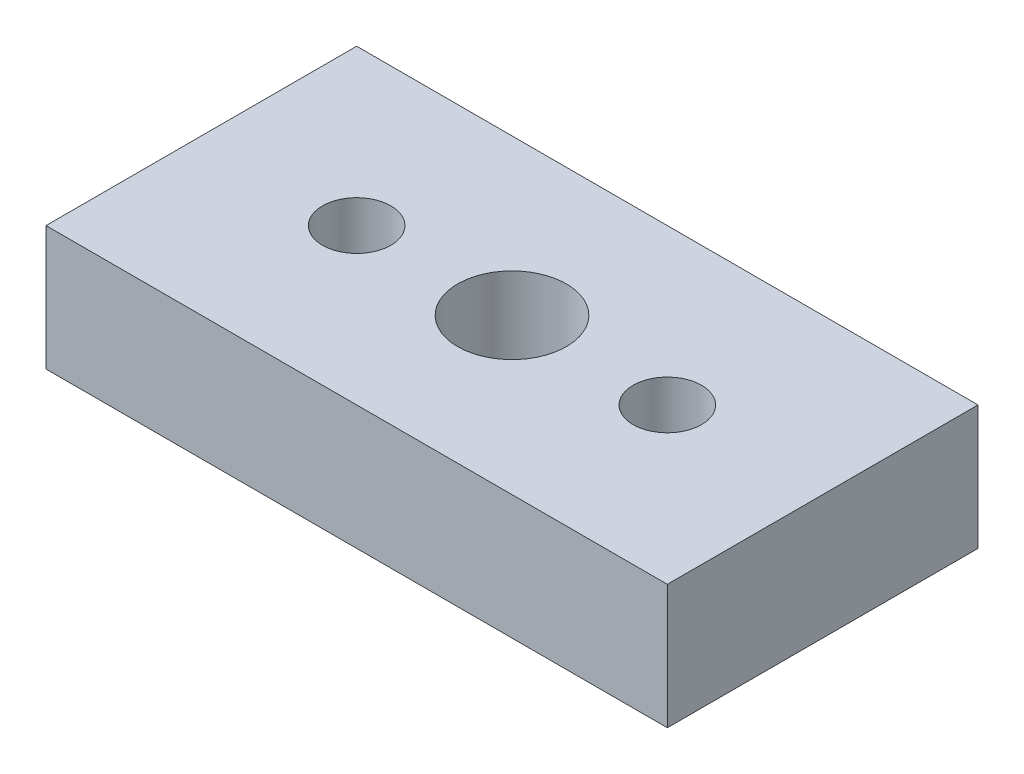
SolidWorks part; units mm, degrees
ref_plane "正面" through (0, 0, 0) normal (0, 0, 1) x (1, 0, 0)
ref_plane "平面" through (0, 0, 0) normal (0, 1, 0) x (1, 0, 0)
ref_plane "右側面" through (0, 0, 0) normal (1, 0, 0) x (0, 0, -1)
sketch "ｽｹｯﾁ1" plane through (0, 0, 0) normal (0, 1, 0) x (1, 0, 0)
  line L1 (-30, 15) -> (30, 15)
  line L2 (-30, 15) -> (-30, -15)
  line L3 (-30, -15) -> (30, -15)
  line L4 (30, 15) -> (30, -15)
  dimension "D1" = 30
  dimension "D2" = 30
  dimension "D3" = 15
  dimension "D4" = 60
extrude "押し出し1" add sketch "ｽｹｯﾁ1" along normal blind 12
hole_wizard "M12x1.5 ねじ穴1" positions "3Dｽｹｯﾁ1" profile "ｽｹｯﾁ2" tap size "M12x1.5" standard "JIS"
sketch3d "3Dｽｹｯﾁ1"
  line L0 (-30, 12, -15) -> (-30, 12, 15) construction
  line L1 (30, 12, -15) -> (-30, 12, -15) construction
  point P0 (0, 12, 0)
  dimension "D1" = 30
  dimension "D2" = 15
sketch "ｽｹｯﾁ2" plane through (0, 12, 0) normal (1, 0, 0) x (0, 0, 1)
  line L0 (0, 0) -> (0, 12)
  line L1 (0, 12) -> (5.25, 12)
  line L2 (5.25, 12) -> (5.25, 0)
  line L5 (5.25, 0) -> (0, 0)
  line L11 (0, -6.35) -> (0, 107.95) construction
  dimension "次ｻｰﾌｪｽまでのねじ下穴ﾄﾞﾘﾙの直径" = 10.5
  dimension "次ｻｰﾌｪｽまでのねじ下穴ﾄﾞﾘﾙの深さ" = 12
hole_wizard "穴1" positions "3Dｽｹｯﾁ3" profile "ｽｹｯﾁ10" legacy
sketch3d "3Dｽｹｯﾁ3"
  line L0 (30, 0, -15) -> (-30, 0, -15) construction
  line L1 (-30, 0, -15) -> (-30, 0, 15) construction
  point P0 (-15, 0, 0)
  point P2 (15, 0, 0)
  dimension "D1" = 15
  dimension "D2" = 15
  dimension "D3" = 30
sketch "ｽｹｯﾁ10" plane through (-15, 0, 0) normal (1, 0, 0) x (0, 0, -1)
  line L0 (0, 0) -> (0, 12)
  line L1 (0, 12) -> (3.3, 12)
  line L2 (3.3, 12) -> (3.3, 6.5)
  line L3 (3.3, 6.5) -> (5.5, 6.5)
  line L4 (5.5, 6.5) -> (5.5, 0)
  line L5 (5.5, 0) -> (0, 0)
  line L6 (0, 110) -> (0, -10) construction
  dimension "直径" = 6.6
  dimension "深さ" = 12
  dimension "座ぐり穴-直径" = 11
  dimension "座ぐり穴-深さ" = 6.5
